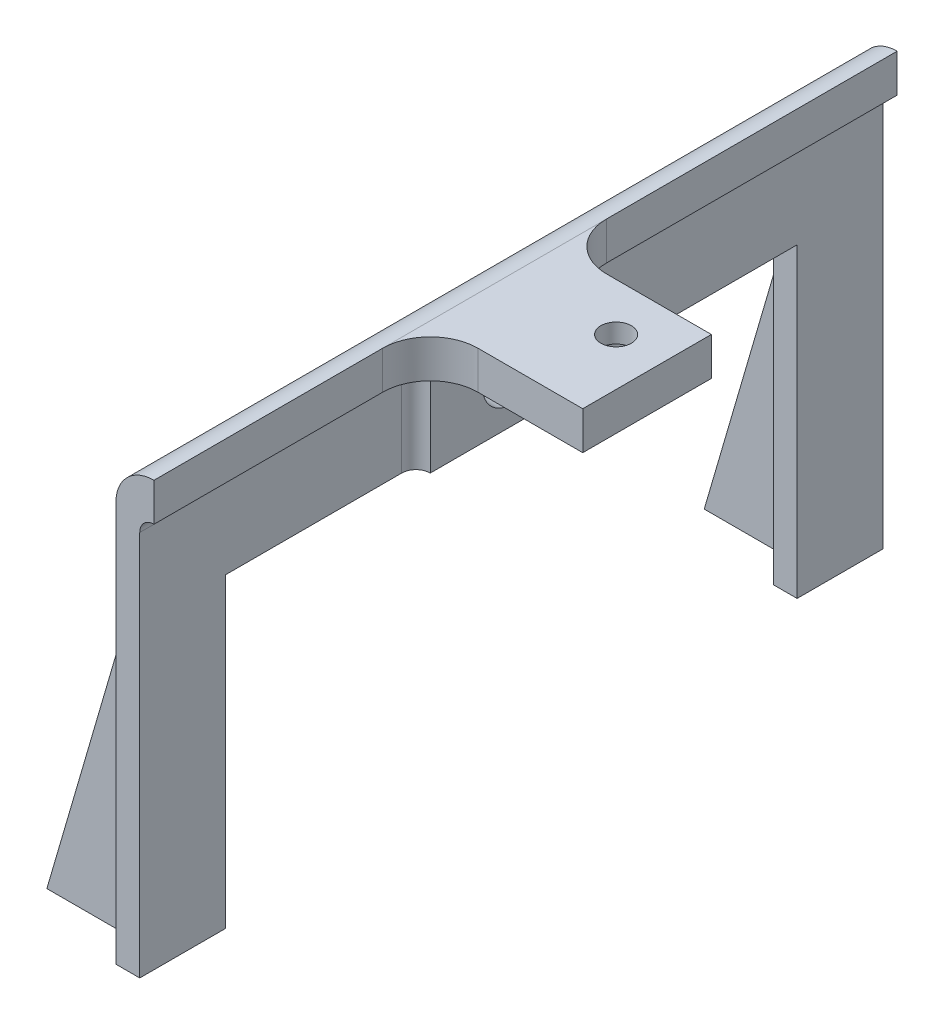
SolidWorks part; units mm, degrees
ref_plane "Plan de face" through (0, 0, 0) normal (0, 0, 1) x (1, 0, 0)
ref_plane "Plan de dessus" through (0, 0, 0) normal (0, 1, 0) x (1, 0, 0)
ref_plane "Plan de droite" through (0, 0, 0) normal (1, 0, 0) x (0, 0, -1)
ref_plane "Plan1" through (0, 5, 0) normal (0, 1, 0) x (1, 0, 0)
sketch "Esquisse3" plane through (0, 5, 0) normal (0, 1, 0) x (1, 0, 0)
  line L0 (-44.1999, 2.5625) -> (-44.1999, 42.4076) construction
  line L1 (-34.8582, 0) -> (-65.097, 0) construction
  line L4 (-46.6999, 2.5625) -> (-46.6999, 42.4076) construction
  line L6 (-44.1999, -30) -> (-46.6999, -30)
  line L7 (-44.1999, 39) -> (-46.6999, 39)
  line L8 (-44.1999, 39) -> (-44.1999, 30)
  line L9 (-44.1999, 30) -> (-46.6999, 30)
  line L10 (-46.6999, 39) -> (-46.6999, 30)
  line L11 (-46.6999, -39) -> (-46.6999, -30)
  line L12 (-44.1999, -39) -> (-46.6999, -39)
  line L13 (-44.1999, -39) -> (-44.1999, -30)
  line L15 (-46.1999, -69.8859) -> (-46.1999, 16.0141) construction
  dimension "D1" = 2.5
  dimension "D2" = 2
extrude "Boss.-Extru.2" add sketch "Esquisse3" along normal blind 42
sketch "Esquisse4" plane through (0, 47, 0) normal (0, 1, 0) x (1, 0, 0)
  line L0 (-46.6999, 41.793) -> (-46.6999, -57.5922) construction
  line L1 (-26.6999, -57.5922) -> (-26.6999, 41.793) construction
  line L2 (-7.7923, 39) -> (-32.5572, 39) construction
  line L3 (-46.6999, 39) -> (-42.6999, 39)
  line L4 (-46.6999, 39) -> (-46.6999, -39)
  line L5 (-46.6999, -39) -> (-42.6999, -39)
  line L6 (-26.6999, 3.5) -> (-26.6999, -10)
  line L8 (-6.0707, -39) -> (-32.5572, -39) construction
  line L10 (-42.6999, -48.6758) -> (-42.6999, 41.793) construction
  line L11 (-60.2179, 0) -> (-27.2155, 0) construction
  line L13 (-39.0269, -1.5) -> (-2.3189, -1.5) construction
  line L14 (-27.2155, 3.5) -> (10.3031, 3.5) construction
  line L15 (-27.2155, -10) -> (10.3031, -10) construction
  line L16 (-42.6999, 39) -> (-42.6999, 8.5)
  line L17 (-37.6999, 3.5) -> (-26.6999, 3.5)
  line L18 (-26.6999, -10) -> (-37.6999, -10)
  line L19 (-42.6999, -15) -> (-42.6999, -39)
  line L20 (-31.6999, -48.6758) -> (-31.6999, 9.2233) construction
  line L21 (-46.6999, 39) -> (-46.6999, 30) construction
  circle A0 centre (-31.6999, -1.5) radius 1.6
  arc A1 (-37.6999, -10) -> (-42.6999, -15) centre (-37.6999, -15) ccw
  arc A2 (-42.6999, 8.5) -> (-37.6999, 3.5) centre (-37.6999, 8.5) ccw
  point P40 (-42.6999, -10)
  point P43 (-42.6999, 3.5)
  dimension "D7" = 5
  dimension "D1" = 20
  dimension "D2" = 4
  dimension "D3" = 5
  dimension "D4" = 13.5
  dimension "D6" = 5
extrude "Boss.-Extru.3" add sketch "Esquisse4" along normal blind 4
sketch "Esquisse5" plane through (0, 47, 0) normal (0, -1, 0) x (1, 0, 0)
  line L2 (-23.0965, 30) -> (-46.6999, 30) construction
  line L7 (-44.1999, -30) -> (-46.6999, -30)
  line L8 (-44.1999, -30) -> (-44.1999, 30)
  line L9 (-44.1999, 30) -> (-46.6999, 30)
  line L10 (-46.6999, -30) -> (-46.6999, 30)
extrude "Boss.-Extru.4" add sketch "Esquisse5" along normal blind 9.85
sketch "Esquisse6" plane through (-44.1999, 0, 0) normal (1, 0, 0) x (0, 0, -1)
  line L0 (-10, 73.066) -> (-10, 50.9487) construction
  line L1 (3.5, 73.8448) -> (3.5, 50.9487) construction
  line L2 (30, 37.15) -> (-30, 37.15) construction
  line L4 (40.8611, 47) -> (-13.2639, 47) construction
  line L6 (-10, 37.15) -> (3.5, 37.15)
  line L7 (-10, 37.15) -> (-10, 47)
  line L8 (-10, 47) -> (3.5, 47)
  line L9 (3.5, 37.15) -> (3.5, 47)
  dimension "D1" = 13.5
extrude "Boss.-Extru.5" add sketch "Esquisse6" along normal blind 1.5
sketch "Esquisse7" plane through (-46.6999, 0, 0) normal (-1, 0, 0) x (0, 0, 1)
  line L0 (-39, 74.7573) -> (-39, 57.1617) construction
  line L1 (-39, 51) -> (-39, 5) construction
  line L2 (1.5, 74.7573) -> (1.5, 57.1617) construction
  line L3 (-50.2313, 51) -> (6.3578, 51) construction
  line L5 (-39, 51) -> (39, 51) construction
  line L6 (-44.8674, 42.15) -> (6.3578, 42.15) construction
  circle A0 centre (1.5, 42.15) radius 1.6
  dimension "D1" = 40.5
  dimension "D2" = 8.85
extrude "Enlèv. mat.-Extru.2" cut sketch "Esquisse7" against normal blind 4
sketch "Esquisse8" plane through (-42.6999, 0, 0) normal (1, 0, 0) x (0, 0, -1)
  circle A0 centre (-1.5, 42.15) radius 3
extrude "Enlèv. mat.-Extru.3" cut sketch "Esquisse8" against normal blind 2
sketch "Esquisse9" plane through (0, 47, 0) normal (0, -1, 0) x (1, 0, 0)
  circle A0 centre (-31.6999, 1.5) radius 3
extrude "Enlèv. mat.-Extru.4" cut sketch "Esquisse9" against normal blind 2
fillet "Congé4" radius 4 1 edges at (-46.6999, 51, 0)
sketch "Esquisse10" plane through (-46.6999, 0, 0) normal (-1, 0, 0) x (0, 0, 1)
  line L0 (43.9687, 5) -> (-48.282, 5) construction
  line L1 (0, 51.8159) -> (0, -6.4079) construction
  line L2 (-48.282, 41) -> (43.9687, 41) construction
  line L3 (-34.5, -10.0374) -> (-34.5, 39.7175) construction
  line L4 (-44.0475, 23) -> (-18.8053, 23) construction
  line L5 (-33.25, -10.0374) -> (-33.25, 43.6527) construction
  line L6 (35.75, 41) -> (33.25, 41)
  line L7 (-35.75, 41) -> (-33.25, 41)
  line L8 (-35.75, 41) -> (-35.75, 5)
  line L9 (-35.75, 5) -> (-33.25, 5)
  line L10 (-33.25, 41) -> (-33.25, 5)
  line L11 (-35.75, 41) -> (-33.25, 5) construction
  line L12 (-35.75, 5) -> (-33.25, 41) construction
  line L13 (35.75, 41) -> (35.75, 5)
  line L14 (33.25, 41) -> (33.25, 5)
  line L15 (35.75, 5) -> (33.25, 5)
  point P15 (-34.5, 23)
  dimension "D1" = 36
  dimension "D2" = 18
  dimension "D3" = 1.25
extrude "Boss.-Extru.6" add sketch "Esquisse10" along normal blind 10.5
sketch "Esquisse11" plane through (0, 0, -35.75) normal (0, 0, -1) x (-1, 0, 0)
  line L0 (46.6999, 41) -> (57.1999, 5)
  line L1 (57.1999, 5) -> (57.1999, 41)
  line L2 (57.1999, 41) -> (46.6999, 41)
  line L4 (57.1999, 41) -> (57.1999, 5) construction
  line L6 (57.1999, 5) -> (46.6999, 5) construction
extrude "Enlèv. mat.-Extru.5" cut sketch "Esquisse11" against normal through all
fillet "Congé5" radius 1.5 7 edges at (-42.6999, 47, 3.25) (-44.1999, 42.075, -3.5) (-43.4499, 47, -3.5) (-44.1999, 42.075, 10) (-43.4499, 47, 10)
sketch "Esquisse12" plane through (0, 5, 0) normal (0, -1, 0) x (1, 0, 0)
  line L0 (-59.98, -34.5) -> (-32.2025, -34.5) construction
  line L1 (-46.6999, -43.5169) -> (-46.6999, -30.9796) construction
  line L2 (-46.6999, -33.25) -> (-46.6999, -30) construction
  line L3 (-45.805, 0) -> (0, 0) construction
  line L4 (-44.8499, -36.1815) -> (-44.8499, -32.8185)
  line L5 (-44.8499, 32.8185) -> (-44.8499, 36.1815)
  circle A0 centre (-46.6999, -34.5) radius 0.9 construction
  arc A1 (-44.8499, -32.8185) -> (-44.8499, -36.1815) centre (-46.6999, -34.5) ccw
  arc A2 (-44.8499, 32.8185) -> (-44.8499, 36.1815) centre (-46.6999, 34.5) cw
  dimension "D1" = 3.7
extrude "Boss.-Extru.7" add sketch "Esquisse12" against normal blind 12 separate body
fillet "Congé6" radius 1.5 1 edges at (-49.1999, 17, -34.5)
fillet "Congé7" radius 1.5 1 edges at (-49.1999, 17, 34.5)
sketch "Esquisse13" plane through (0, 5, 0) normal (0, -1, 0) x (1, 0, 0)
  circle A0 centre (-46.6999, -34.5) radius 0.9
  circle A1 centre (-46.6999, 34.5) radius 0.9
extrude "Enlèv. mat.-Extru.6" cut sketch "Esquisse13" against normal blind 12
